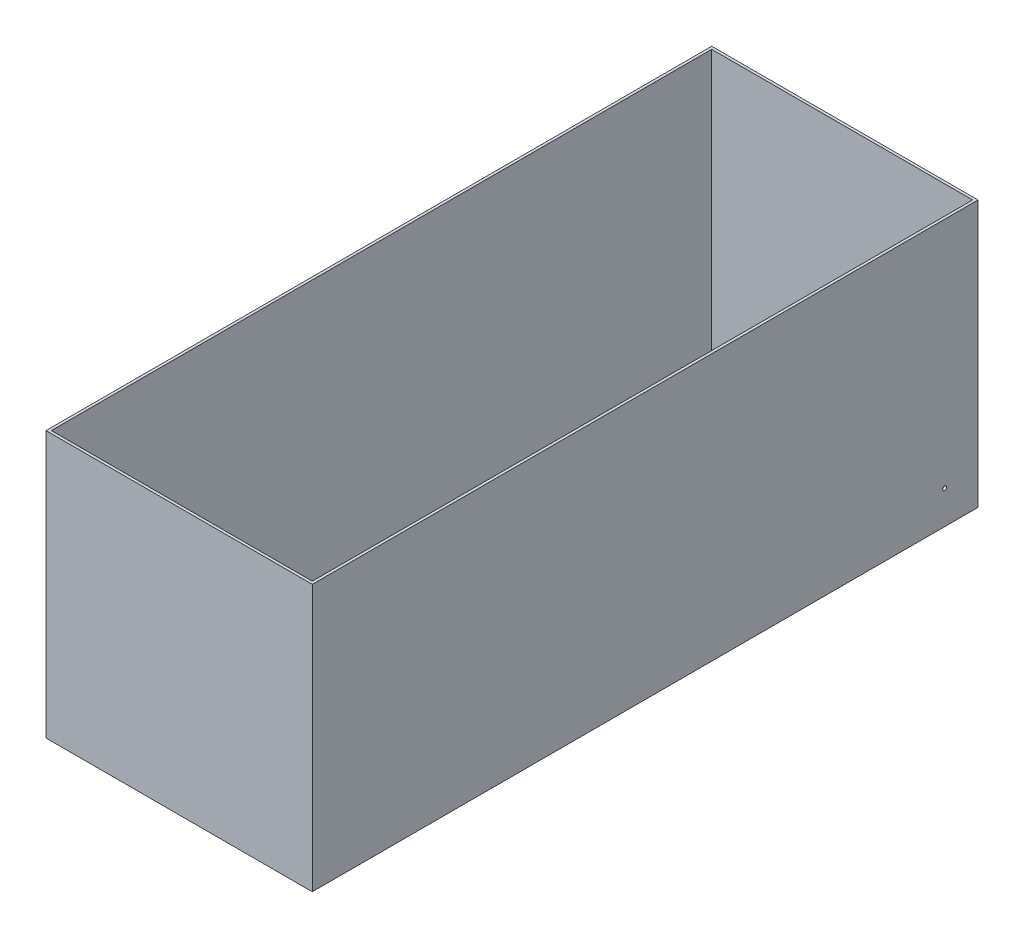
SolidWorks part; units mm, degrees
ref_plane "Alzado" through (0, 0, 0) normal (0, 0, 1) x (1, 0, 0)
ref_plane "Planta" through (0, 0, 0) normal (0, 1, 0) x (1, 0, 0)
ref_plane "Vista lateral" through (0, 0, 0) normal (1, 0, 0) x (0, 0, -1)
sketch "Croquis1" plane through (0, 0, 0) normal (0, 1, 0) x (1, 0, 0)
  line L1 (-100, -250) -> (100, -250)
  line L2 (-100, -250) -> (-100, 250)
  line L3 (-100, 250) -> (100, 250)
  line L4 (100, -250) -> (100, 250)
  line L5 (-100, -250) -> (100, 250) construction
  line L6 (-100, 250) -> (100, -250) construction
  point P0 (0, 0)
  dimension "D1" = 200
  dimension "D2" = 500
extrude "Saliente-Extruir1" add sketch "Croquis1" along normal blind 200
shell "Vaciado1" thickness 2
sketch "Croquis2" plane through (100, 0, 0) normal (1, 0, 0) x (0, 0, -1)
  line L0 (250, 200) -> (250, 0) construction
  line L1 (-250, 0) -> (250, 0) construction
  circle A0 centre (225, 25) radius 1.5
  dimension "D1" = 25
  dimension "D2" = 25
  dimension "D3" = 3
extrude "Cortar-Extruir1" cut sketch "Croquis2" against normal blind 43
sketch "Croquis3" plane through (-100, 0, 0) normal (-1, 0, 0) x (0, 0, 1)
  line L0 (250, 200) -> (250, 0) construction
  line L1 (-250, 200) -> (250, 200) construction
  circle A0 centre (225, 175) radius 1.5
  dimension "D1" = 3
  dimension "D2" = 25
  dimension "D3" = 25
extrude "Cortar-Extruir2" cut sketch "Croquis3" against normal blind 43
